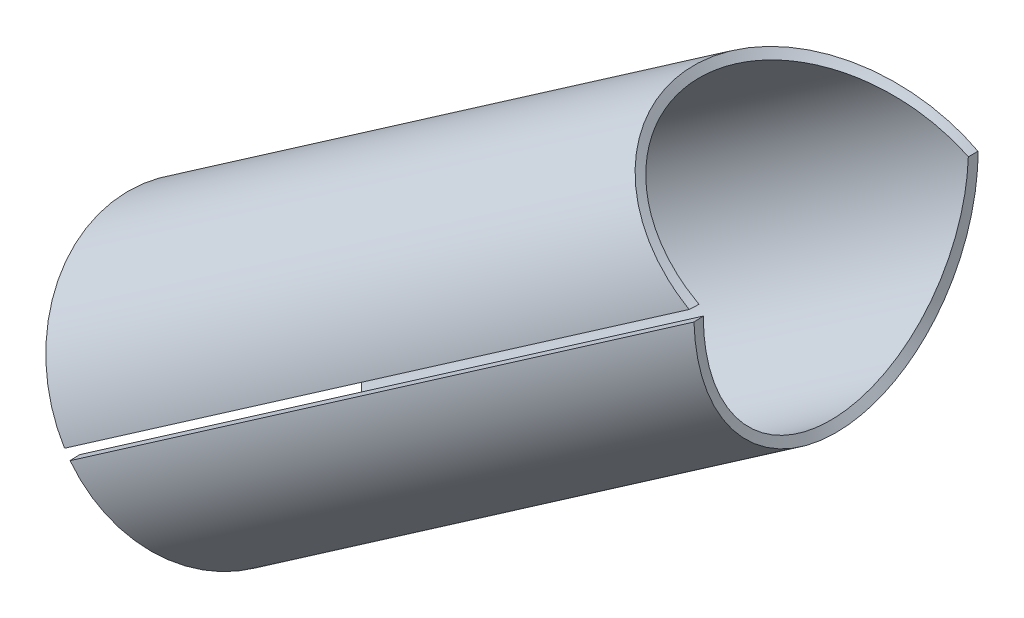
SolidWorks part; units mm, degrees
ref_plane "前视基准面" through (0, 0, 0) normal (0, 0, 1) x (1, 0, 0)
ref_plane "上视基准面" through (0, 0, 0) normal (0, 1, 0) x (1, 0, 0)
ref_plane "右视基准面" through (0, 0, 0) normal (1, 0, 0) x (0, 0, -1)
imported_body "基体零件-任意角度Y形三通管-1"
sheet metal parameters "钣金1" parameters "D1"=0.7366, "厚度"=1
bend "圆角折弯1" bend radius 13.6769 bend angle 356.095 parameters "D5"=1
flatten bends "展开-折弯1"
sketch "尖角-草图1" plane through (-32.2324, -22.9269, 14.6684) normal (0.0194, -0.028, 0.9994) x (0.9998, 0.0005, -0.0194)
  line L0 (56.4586, -12.6147) -> (-8.0529, -57.2586) construction
  dimension "D1" = 0
process bends "加工-折弯1" parameters "D1"=0
sketch "平面-草图1" plane through (-32.2324, -22.9269, 14.6684) normal (0.0194, -0.028, 0.9994) x (0.9998, 0.0005, -0.0194)
